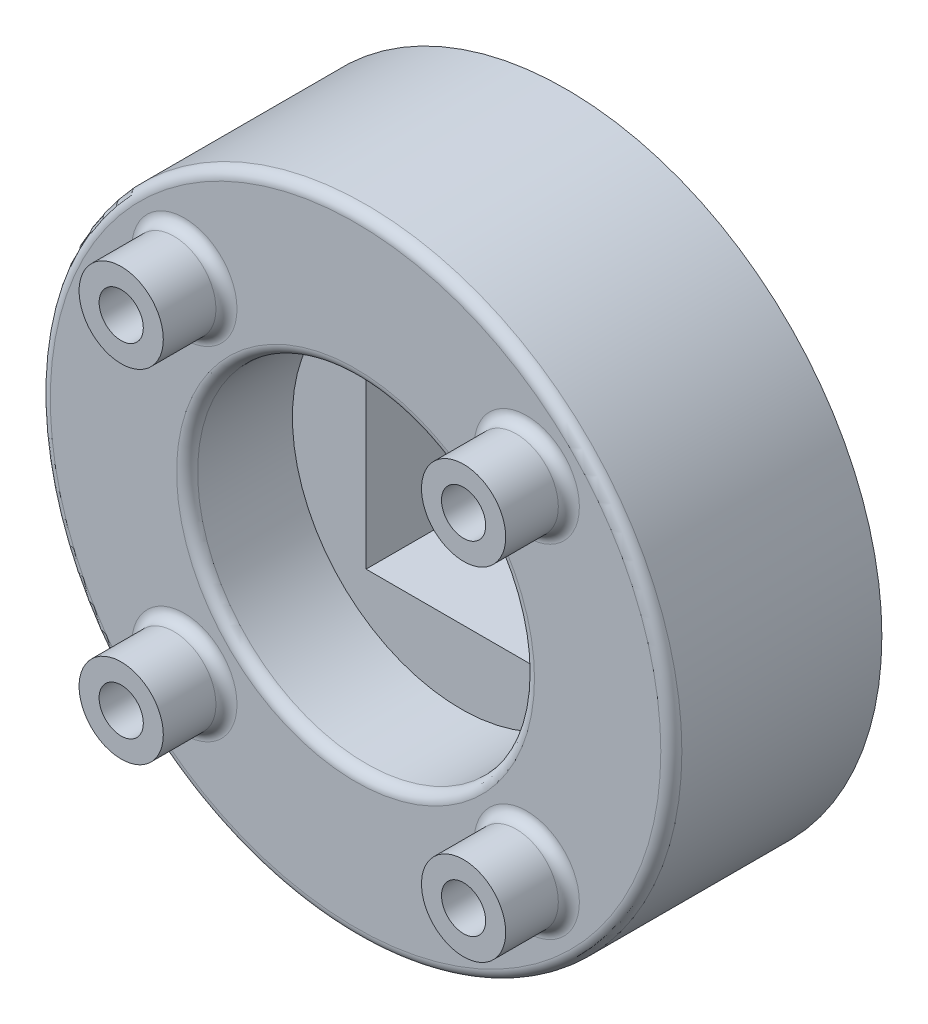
SolidWorks part; units mm, degrees
ref_plane "Front Plane" through (0, 0, 0) normal (0, 0, 1) x (1, 0, 0)
ref_plane "Top Plane" through (0, 0, 0) normal (0, 1, 0) x (1, 0, 0)
ref_plane "Right Plane" through (0, 0, 0) normal (1, 0, 0) x (0, 0, -1)
sketch "Sketch1" plane through (0, 0, 0) normal (0, 0, 1) x (1, 0, 0)
  circle A0 centre (0, 0) radius 75
  dimension "D1" = 150
extrude "Boss-Extrude1" add sketch "Sketch1" along normal blind 50
sketch "Sketch2" plane through (0, 0, 50) normal (0, 0, 1) x (1, 0, 0)
  line L1 (-22.5, -22.5) -> (22.5, -22.5)
  line L2 (-22.5, -22.5) -> (-22.5, 22.5)
  line L3 (-22.5, 22.5) -> (22.5, 22.5)
  line L4 (22.5, -22.5) -> (22.5, 22.5)
  line L5 (-22.5, -22.5) -> (22.5, 22.5) construction
  line L6 (-22.5, 22.5) -> (22.5, -22.5) construction
  point P0 (0, 0)
  dimension "D1" = 45
extrude "Cut-Extrude3" cut sketch "Sketch2" against normal through all
sketch "Sketch3" plane through (0, 0, 50) normal (0, 0, 1) x (1, 0, 0)
  circle A0 centre (0, 0) radius 40
  dimension "D1" = 80
extrude "Cut-Extrude2" cut sketch "Sketch3" against normal blind 25
sketch "Sketch4" plane through (0, 0, 50) normal (0, 0, 1) x (1, 0, 0)
  line L1 (40.6586, -40.6586) -> (-40.6586, -40.6586) construction
  line L2 (40.6586, -40.6586) -> (40.6586, 40.6586) construction
  line L3 (40.6586, 40.6586) -> (-40.6586, 40.6586) construction
  line L4 (-40.6586, -40.6586) -> (-40.6586, 40.6586) construction
  line L5 (40.6586, -40.6586) -> (-40.6586, 40.6586) construction
  line L6 (40.6586, 40.6586) -> (-40.6586, -40.6586) construction
  circle A0 centre (0, 0) radius 57.5 construction
  circle A1 centre (-40.6586, 40.6586) radius 10
  circle A2 centre (40.6586, 40.6586) radius 10
  circle A3 centre (40.6586, -40.6586) radius 10
  circle A4 centre (-40.6586, -40.6586) radius 10
  dimension "D1" = 115
  dimension "D2" = 20
extrude "Boss-Extrude3" add sketch "Sketch4" along normal blind 15
hole_wizard "M12x1.5 Tapped Hole1" positions "Sketch5" profile "Sketch6" tap size "M12x1.5" standard "ANSI Metric"
sketch "Sketch5" plane through (0, 0, 65) normal (0, 0, 1) x (1, 0, 0)
  point P0 (-40.6586, 40.6586)
  point P3 (40.6586, 40.6586)
  point P6 (40.6586, -40.6586)
  point P9 (-40.6586, -40.6586)
sketch "Sketch6" plane through (-40.6586, 40.6586, 65) normal (1, 0, 0) x (0, -1, 0)
  line L0 (0, 0) -> (0, 34.6545)
  line L1 (0, 34.6545) -> (5.25, 31.5)
  line L2 (5.25, 31.5) -> (5.25, 0)
  line L5 (5.25, 0) -> (0, 0)
  line L10 (0, 34.6545) -> (-5.25, 31.5) construction
  line L11 (0, -6.35) -> (0, 107.95) construction
  dimension "Tap Drill Dia." = 10.5
  dimension "Tap Drill Depth" = 31.5
  dimension "Drill Angle" = 118
fillet "Fillet1" radius 2.5 6 edges at (75, 0, 50) (40, 0, 50) (-30.6586, 40.6586, 50) (50.6586, 40.6586, 50) (50.6586, -40.6586, 50) (-30.6586, -40.6586, 50)
